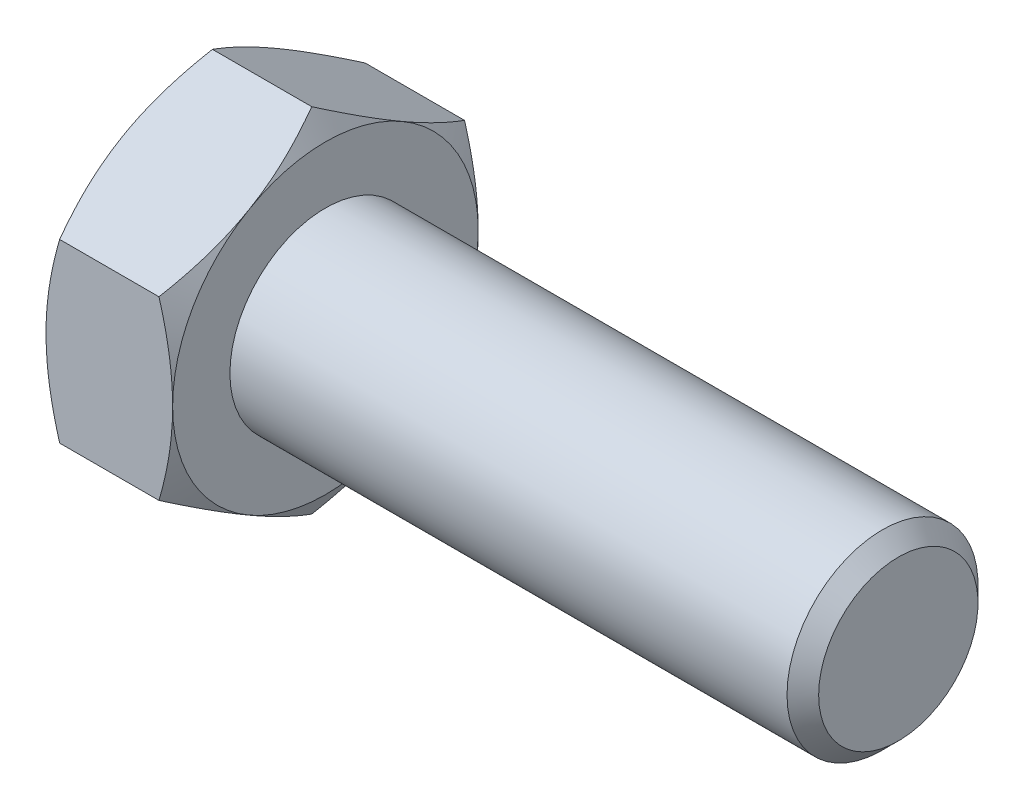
SolidWorks part; units mm, degrees
ref_plane "Plane1" through (0, 0, 0) normal (0, 0, 1) x (1, 0, 0)
ref_plane "Plane2" through (0, 0, 0) normal (0, 1, 0) x (1, 0, 0)
ref_plane "Plane3" through (0, 0, 0) normal (1, 0, 0) x (0, 0, -1)
extrude "BaseHead" add sketch "Sketch1" along normal blind 6.63
sketch "Sketch1" plane through (0, 0, 0) normal (1, 0, 0) x (0, 0, -1)
  line L0 (8, 4.6188) -> (8, -4.6188)
  line L1 (-8, 4.6188) -> (-8, -4.6188)
  line L2 (8, -4.6188) -> (0, -9.2376)
  line L3 (0, -9.2376) -> (-8, -4.6188)
  line L4 (8, 4.6188) -> (0, 9.2376)
  line L5 (0, 9.2376) -> (-8, 4.6188)
  dimension "Width_flats" = 16
  dimension "D2" = 120
  dimension "D3" = 8
  dimension "D4" = 8
  dimension "D5" = 8
revolve "BaseBody" add sketch "BodySke"
sketch "BodySke" plane through (0, 0, 0) normal (0, 0, 1) x (1, 0, 0)
  line L0 (0, 4.6188) -> (0, -4.6188) construction
  line L1 (0, 0) -> (36.63, 0)
  line L2 (0, 0) -> (0, 5)
  line L3 (0, 5) -> (35.802, 5)
  line L4 (36.63, 0) -> (36.63, 4.172)
  line L5 (6.63, 9.2376) -> (6.63, 4.6188) construction
  line L6 (36.63, 4.172) -> (35.802, 5)
  line L7 (0, 0) -> (96.52, 0) construction
  line L8 (36.63, -4.172) -> (35.802, -5) construction
  line L9 (0, -5) -> (35.802, -5) construction
  line L10 (8.13, 15.24) -> (8.13, -1.27) construction
  line L11 (11.63, 15.24) -> (11.63, -1.27) construction
  line L12 (6.63, 4.6188) -> (6.63, -4.6188) construction
  dimension "Length" = 30
  dimension "Body_ch_ang" = 45
  dimension "Diameter" = 10
  dimension "Minor_dia" = 8.344
  dimension "Advance" = 1.5
  dimension "Thread_nom" = 25
fillet "HeadFillet" radius 0.4
sketch "Sketch6"
  circle A0 centre (0.0332, 0.1924) radius 7
  dimension "D1" = 14
revolve "HeadChamfer" cut sketch "Sketch3" angle 360 about L6
sketch "Sketch3" plane through (0, 0, 0) normal (0, 0, 1) x (1, 0, 0)
  line L0 (0, 8) -> (3.6013, 14.2376)
  line L1 (0, 9.2376) -> (0, 4.6188) construction
  line L2 (3.6013, 14.2376) -> (3.6013, 19.2376)
  line L3 (3.6013, 19.2376) -> (-10, 19.2376)
  line L4 (-10, 19.2376) -> (-10, 8)
  line L5 (-10, 8) -> (0, 8)
  line L6 (0, 0) -> (99.06, 0) construction
  line L7 (6.63, 9.2376) -> (0, 9.2376) construction
  dimension "D1" = 8
  dimension "D2" = 5
  dimension "D3" = 10
  dimension "D4" = 5
  dimension "Head_ch_ang" = 30
extrude "Indent" cut sketch "Sketch6" against normal blind 0.8287
sketch "Sketch5" plane through (0, 0, 0) normal (0, 0, 1) x (1, 0, 0)
  line L0 (6.63, 8) -> (3.0287, 14.2376)
  line L1 (6.63, 9.2376) -> (6.63, 4.6188) construction
  line L2 (3.0287, 14.2376) -> (3.0287, 19.2376)
  line L3 (3.0287, 19.2376) -> (13.0287, 19.2376)
  line L4 (13.0287, 19.2376) -> (13.0287, 8)
  line L5 (13.0287, 8) -> (6.63, 8)
  line L7 (6.63, 9.2376) -> (0.7145, 9.2376) construction
  line L8 (0, 0) -> (99.06, 0) construction
  line L9 (0, 0) -> (99.06, 0) construction
  dimension "D1" = 8
  dimension "D2" = 5
  dimension "D3" = 10
  dimension "Head_ch_ang" = 30
  dimension "D4" = 5
revolve "UnderHeadChamfer" cut sketch "Sketch5" angle 360 about L8
sketch "Sketch4" plane through (0, 0, 0) normal (0, 0, 1) x (1, 0, 0)
  line L1 (6.63, 9.2376) -> (6.63, 4.6188) construction
  line L2 (6.63, 8) -> (6.03, 8)
  line L3 (6.63, 8) -> (6.63, 19.2376)
  line L4 (6.63, 19.2376) -> (6.03, 19.2376)
  line L5 (0, 0) -> (95.25, 0) construction
  line L6 (0, 0) -> (96.52, 0) construction
  line L7 (6.03, 8) -> (6.03, 19.2376)
  line L8 (5.9155, 9.2376) -> (0.7145, 9.2376) construction
  dimension "D1" = 16
  dimension "D2" = 10
  dimension "Bearing_ht" = 0.6
revolve "BearingFace" cut sketch "Sketch4" angle 360 about L5
sketch "ThdSchSke" plane through (0, 0, 0) normal (0, 0, 1) x (1, 0, 0)
  line L0 (11.63, -4.172) -> (11.0502, -5)
  line L1 (11.63, -4.172) -> (12.2098, -5)
  line L2 (12.2098, -5) -> (12.2098, -6.25)
  line L3 (-3.175, 0) -> (5.1513, 0) construction
  line L5 (12.2098, -6.25) -> (11.0502, -6.25)
  line L6 (11.0502, -6.25) -> (11.0502, -5)
  dimension "Thread_minor" = 8.344
  dimension "Diameter" = 10
  dimension "Start" = 11.63
  dimension "SideAngle" = 55
  dimension "VeeAngle" = 70
  dimension "Overcut" = 12.5
revolve "ThreadSchematic" cut sketch "ThdSchSke" angle 360 about L3
pattern_linear "ThdSchPat"
equation "\"D3@Sketch1\" = \"Width_flats@Sketch1\" / 2"
equation "\"D4@Sketch1\" = \"D3@Sketch1\""
equation "\"D5@Sketch1\" = \"D4@Sketch1\""
equation "\"Thread_minor@ThreadCosmetic\" = \"Minor_dia@BodySke\""
equation "\"D1@Sketch3\" = \"Width_flats@Sketch1\" / 2"
equation "\"D1@Sketch5\" = \"Width_flats@Sketch1\" / 2"
equation "\"Head_ch_ang@Sketch5\" = \"Head_ch_ang@Sketch3\""
equation "\"D1@Sketch4\" = \"Width_flats@Sketch1\""
equation "\"D1@Sketch6\" = \"Width_flats@Sketch1\" * 7/8"
equation "\"D1@Indent\" = \"Head_ht@BaseHead\" / 8"
equation "\"Thread_length@ThreadCosmetic\" = ((sgn( (\"Length@BodySke\" - \"Advance@BodySke\" ) - \"Thread_nom@BodySke\" )-1)*( (\"Length@BodySke\" - \"Advance@BodySke\" ) - \"Thread_nom@BodySke\" ))/-2+ \"Thread_nom@BodySke\""
equation "\"Thread_minor@ThdSchSke\" = \"Minor_dia@BodySke\""
equation "\"Diameter@ThdSchSke\" = \"Diameter@BodySke\""
equation "\"Overcut@ThdSchSke\" = \"Diameter@BodySke\" * 1.25"
equation "\"Start@ThdSchSke\" = \"Head_ht@BaseHead\" + \"Length@BodySke\" - \"Thread_length@ThreadCosmetic\"  '---Non-countersunk---"
equation "\"Num_threads@ThdSchPat\" = int( \"Thread_length@ThreadCosmetic\" / \"Advance@BodySke\" + 0.999 )  + 1"
equation "\"Advance@ThdSchPat\" = \"Thread_length@ThreadCosmetic\" /  (\"Num_threads@ThdSchPat\" - 1) 'relax it"
equation "\"Num_threads@ThdSchPat\" = \"Num_threads@ThdSchPat\" - sgn( \"Num_threads@ThdSchPat\" - 1) '---chamfered tips only---"
